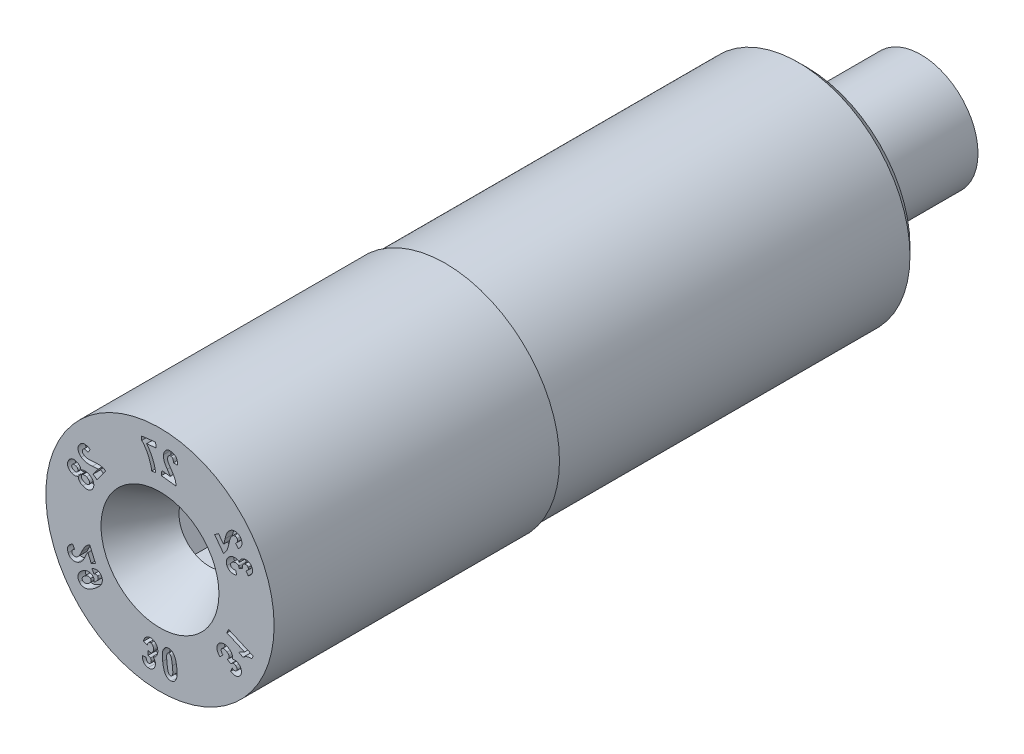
SolidWorks part; units mm, degrees
other "<M3L6-SetScrew>-<Chamfer1>"
ref_plane "Front Plane" through (0, 0, 0) normal (0, 0, 1) x (1, 0, 0)
ref_plane "Top Plane" through (0, 0, 0) normal (0, 1, 0) x (1, 0, 0)
ref_plane "Right Plane" through (0, 0, 0) normal (1, 0, 0) x (0, 0, -1)
sketch "Sketch1" plane through (0, 0, 0) normal (1, 0, 0) x (0, 0, -1)
  line L0 (0, 1.55) -> (1.299, 0.8)
  line L2 (0, 3) -> (0, 1.55)
  line L3 (16.7125, 3) -> (0, 3)
  line L4 (-3.7979, 0) -> (49996.2021, 0) construction
  line L8 (14, 0.8) -> (1.299, 0.8)
  line L12 (17, 1.5) -> (17, 2.7125)
  line L16 (17, 2.7125) -> (16.7125, 3)
  line L17 (17, 1.5) -> (14, 1.5)
  line L18 (14, 0.8) -> (14, 1.5)
  dimension "D1" = 17
  dimension "D2" = 45
  dimension "D3" = 0.2875
  dimension "D4" = 6
  dimension "D5" = 30
  dimension "D6" = 1.55
  dimension "D7" = 1.6
  dimension "D8" = 3
  dimension "D9" = 3
revolve "Revolve1" add sketch "Sketch1" angle 360 about L4
sketch "Sketch5" plane through (0, 0, 0) normal (1, 0, 0) x (0, 0, -1)
  line L0 (0, 0) -> (50000, 0) construction
  line L1 (0, 3) -> (0, -3) construction
  line L2 (7.5, 2.935) -> (17, 2.935)
  line L3 (7.5, 2.935) -> (7.5, 3.935)
  line L4 (7.5, 3.935) -> (17, 3.935)
  line L5 (17, 2.935) -> (17, 3.935)
  line L6 (17, -2.7125) -> (17, 2.7125) construction
  line L7 (16.7125, 3) -> (0, 3) construction
  dimension "D1" = 7.5
  dimension "D2" = 0.065
  dimension "D3" = 1
revolve "Cut-Revolve1" cut sketch "Sketch5" angle 360 about L0
sketch "Sketch2" plane through (0, 0, 0) normal (0, 0, 1) x (1, 0, 0)
  line L0 (0, 0) -> (0, 3) construction
  line L1 (0, 0) -> (2.5981, 1.5) construction
  line L2 (0, 0) -> (2.5981, -1.5) construction
  line L3 (0, 0) -> (0, -3) construction
  line L4 (0, 0) -> (-2.5981, -1.5) construction
  line L5 (0, 0) -> (-2.5981, 1.5) construction
  circle A0 centre (0, 0) radius 3 construction
  arc A1 (0.4389, 1.8871) -> (1.24, 1.4888) centre (0, 0) ccw construction
  text T0 "27     28     29     30     31     32" font "Arial Narrow" height 0.7
  point P17 (0, 0)
  dimension "D1" = 6
  dimension "D2" = 3.875
extrude "Cut-Extrude1" cut sketch "Sketch2" against normal blind 0.2
ref_plane "Plane1" through (0, 0, -1.299) normal (0, 0, 1) x (1, 0, 0)
sketch "Sketch7" plane through (0, 0, -1.299) normal (0, 0, 1) x (1, 0, 0)
  line L1 (0.9238, 0) -> (0.4619, 0.8)
  line L2 (0.4619, 0.8) -> (-0.4619, 0.8)
  line L3 (-0.4619, 0.8) -> (-0.9238, 0)
  line L4 (-0.9238, 0) -> (-0.4619, -0.8)
  line L5 (-0.4619, -0.8) -> (0.4619, -0.8)
  line L6 (0.4619, -0.8) -> (0.9238, 0)
  circle A0 centre (0, 0) radius 0.8 construction
  circle A1 centre (0, 0) radius 0.8 construction
  point P1 (0, 0.8)
extrude "Cut-Extrude2" cut sketch "Sketch7" against normal blind 1.6
inserted part "M3L6-SetScrew"
move or copy body "Body-Move/Copy2" placed by mates yes
other "Distance1" parameters "D1"=3
